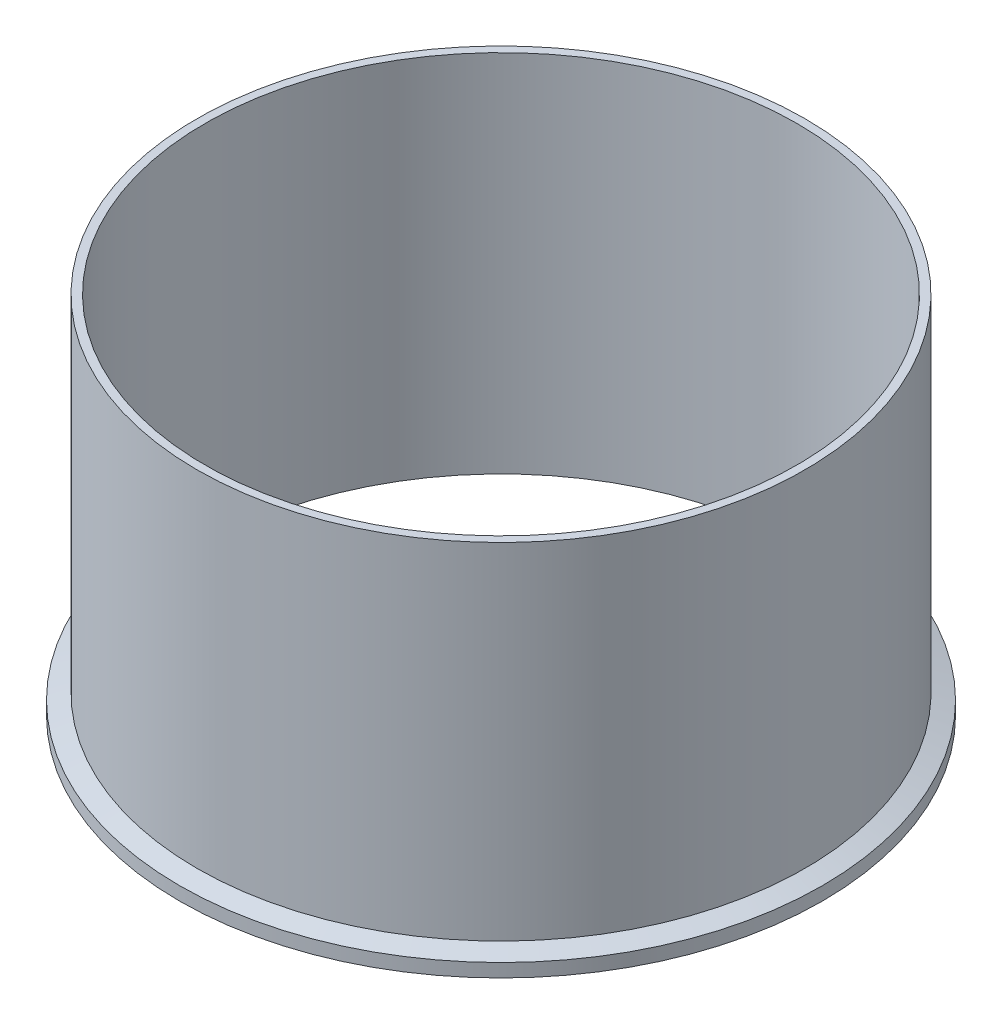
SolidWorks part; units mm, degrees
ref_plane "Front Plane" through (0, 0, 0) normal (0, 0, 1) x (1, 0, 0)
ref_plane "Top Plane" through (0, 0, 0) normal (0, 1, 0) x (1, 0, 0)
ref_plane "Right Plane" through (0, 0, 0) normal (1, 0, 0) x (0, 0, -1)
sketch "Sketch1" plane through (0, 0, 0) normal (0, 0, 1) x (1, 0, 0)
  line L0 (0, 0) -> (0, 152.4) construction
  line L1 (0, 152.4) -> (-127, 152.4)
  line L2 (-127, 152.4) -> (-127, 8.2228)
  line L3 (-127, 8.2228) -> (-134.239, 5.588)
  line L4 (-134.239, 5.588) -> (-134.239, 0)
  line L5 (-134.239, 0) -> (-130.7992, 0)
  line L6 (-127.1632, 0) -> (0, 0)
  line L7 (0, 0) -> (0, 152.4)
  line L8 (0, 152.4) -> (-123.5964, 152.4)
  line L9 (-123.5964, 152.4) -> (-123.5964, 0)
  line L10 (-123.5964, 0) -> (0, 0)
  line L11 (0, 0) -> (-0.1846, 0.0129)
  arc A0 (-130.0767, 0.4745) -> (-127.8857, 0.4745) centre (-128.9812, 0) cw
  arc A1 (-127.1632, 0) -> (-127.8857, 0.4745) centre (-127.1632, 0.7874) cw
  arc A2 (-130.0767, 0.4745) -> (-130.7992, 0) centre (-130.7992, 0.7874) cw
  point P12 (-127.7874, 0)
  dimension "D6" = 1.1938
  dimension "D7" = 0.7874
  dimension "3.00" = 127
  dimension "D2" = 5.588
  dimension "D3" = 134.239
  dimension "D4" = 70
  dimension "D5" = 128.9812
  dimension "D8" = 3.4036
  dimension "D9" = 152.4
revolve "Revolve2" add sketch "Sketch1" angle 360 about L0
